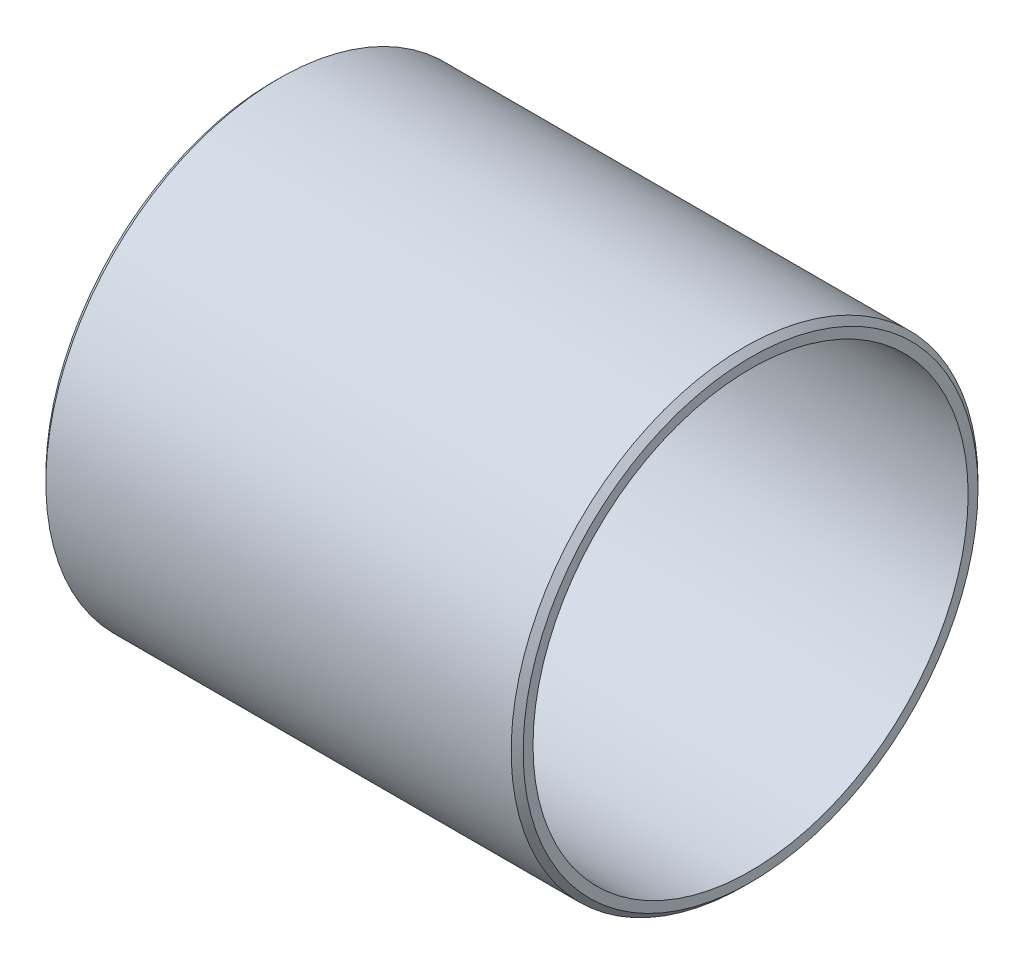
SolidWorks part; units mm, degrees
ref_plane "Front Plane" through (0, 0, 0) normal (0, 0, 1) x (1, 0, 0)
ref_plane "Top Plane" through (0, 0, 0) normal (0, 1, 0) x (1, 0, 0)
ref_plane "Right Plane" through (0, 0, 0) normal (1, 0, 0) x (0, 0, -1)
sketch "Sketch1" plane through (0, 0, 0) normal (1, 0, 0) x (0, 0, -1)
  circle A0 centre (0, 0) radius 30.9309
  circle A1 centre (0, 0) radius 28.829
  dimension "D1" = 61.8617
  dimension "D2" = 57.658
extrude "Boss-Extrude1" add sketch "Sketch1" along normal mid plane 63.246
chamfer "Chamfer1" distance 0.7937 angle 45 2 edges at (31.623, 0, -30.9309) (-31.623, 0, -30.9309)
